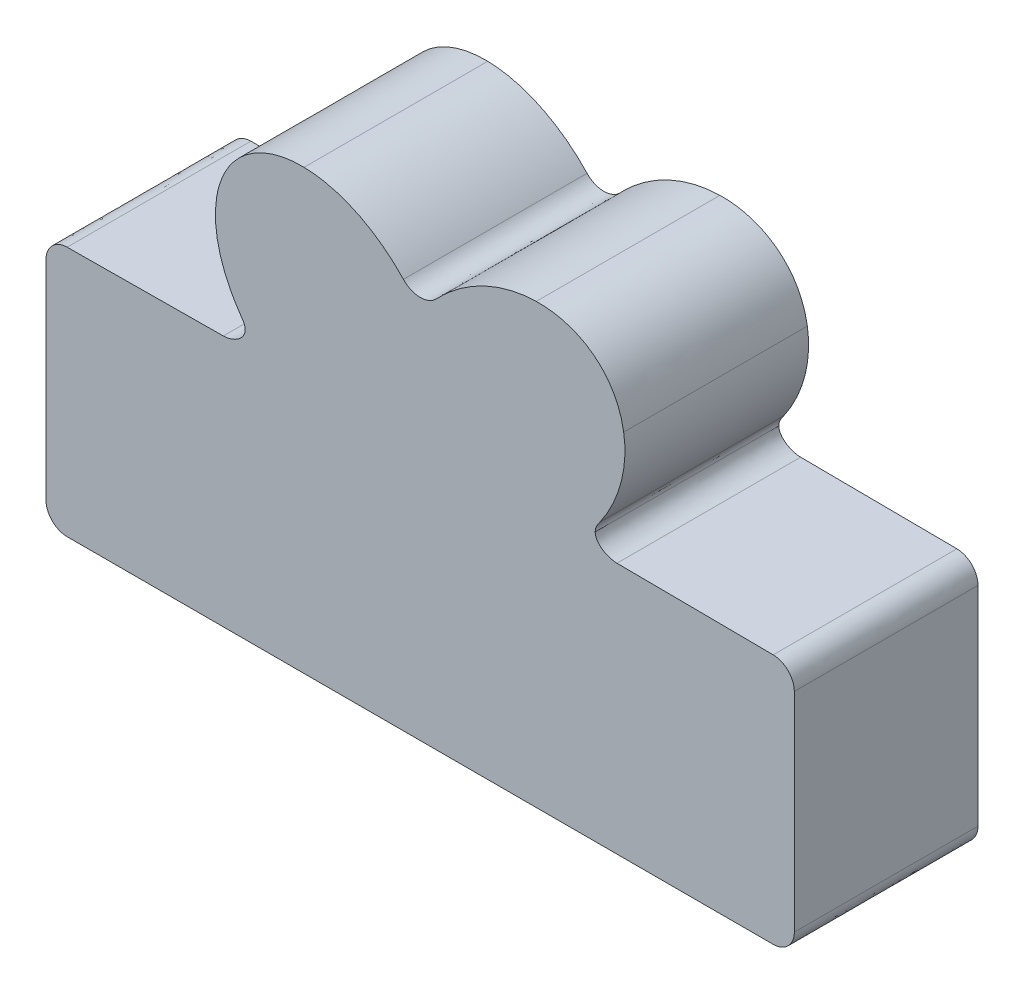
SolidWorks part; units mm, degrees
ref_plane "Front Plane" through (0, 0, 0) normal (0, 0, 1) x (1, 0, 0)
ref_plane "Top Plane" through (0, 0, 0) normal (0, 1, 0) x (1, 0, 0)
ref_plane "Right Plane" through (0, 0, 0) normal (1, 0, 0) x (0, 0, -1)
sketch "Sketch1" plane through (0, 0, 0) normal (0, 0, 1) x (1, 0, 0)
  spline S0 degree 3 poles (569.776, 314.7059) (569.9964, 313.3349) (569.5259, 311.9156) (568.741, 310.7959) knots 0 0 0 0 0.047619 0.047619 0.047619 0.047619
  spline S1 degree 3 poles (568.741, 310.7959) (568.6346, 310.644) (568.5341, 310.519) (568.5351, 310.3218) knots 0.047619 0.047619 0.047619 0.047619 0.095238 0.095238 0.095238 0.095238
  spline S2 degree 3 poles (568.5351, 310.3218) (568.5375, 309.9023) (569.078, 309.6176) (569.4831, 309.6146) knots 0.095238 0.095238 0.095238 0.095238 0.142857 0.142857 0.142857 0.142857
  spline S3 degree 2 poles (569.4831, 309.6146) (569.4831, 309.6146) (576.2875, 309.5617) knots 0.142857 0.142857 0.142857 0.190476 0.190476 0.190476
  spline S4 degree 3 poles (576.2875, 309.5617) (576.7938, 309.5579) (577.2084, 309.1471) (577.2084, 308.6408) knots 0.190476 0.190476 0.190476 0.190476 0.238095 0.238095 0.238095 0.238095
  spline S5 degree 2 poles (577.2084, 308.6408) (577.2084, 308.6408) (577.2084, 299.5617) knots 0.238095 0.238095 0.238095 0.285714 0.285714 0.285714
  spline S6 degree 3 poles (577.2084, 299.5617) (577.2084, 299.0554) (576.794, 298.6397) (576.2875, 298.6408) knots 0.285714 0.285714 0.285714 0.285714 0.333333 0.333333 0.333333 0.333333
  spline S7 degree 2 poles (576.2875, 298.6408) (576.2875, 298.6408) (545.5351, 298.6408) knots 0.333333 0.333333 0.333333 0.380952 0.380952 0.380952
  spline S8 degree 3 poles (545.5351, 298.6408) (545.0286, 298.6397) (544.6142, 299.0554) (544.6142, 299.5617) knots 0.380952 0.380952 0.380952 0.380952 0.428571 0.428571 0.428571 0.428571
  spline S9 degree 2 poles (544.6142, 299.5617) (544.6142, 299.5617) (544.6142, 308.6408) knots 0.428571 0.428571 0.428571 0.47619 0.47619 0.47619
  spline S10 degree 3 poles (544.6142, 308.6408) (544.6142, 309.1471) (545.0288, 309.5579) (545.5351, 309.5617) knots 0.47619 0.47619 0.47619 0.47619 0.52381 0.52381 0.52381 0.52381
  spline S11 degree 2 poles (545.5351, 309.5617) (545.5351, 309.5617) (552.3395, 309.6146) knots 0.52381 0.52381 0.52381 0.571429 0.571429 0.571429
  spline S12 degree 3 poles (552.3395, 309.6146) (552.7446, 309.6176) (553.2851, 309.9023) (553.2875, 310.3218) knots 0.571429 0.571429 0.571429 0.571429 0.619048 0.619048 0.619048 0.619048
  spline S13 degree 3 poles (553.2875, 310.3218) (553.2885, 310.519) (553.188, 310.644) (553.0816, 310.7959) knots 0.619048 0.619048 0.619048 0.619048 0.666667 0.666667 0.666667 0.666667
  spline S14 degree 3 poles (553.0816, 310.7959) (552.2967, 311.9156) (551.8262, 313.3349) (552.0466, 314.7059) knots 0.666667 0.666667 0.666667 0.666667 0.714286 0.714286 0.714286 0.714286
  spline S15 degree 3 poles (552.0466, 314.7059) (552.3552, 316.6254) (553.9301, 317.7737) (555.8547, 317.7338) knots 0.714286 0.714286 0.714286 0.714286 0.761905 0.761905 0.761905 0.761905
  spline S16 degree 3 poles (555.8547, 317.7338) (557.5018, 317.6997) (559.07, 316.8576) (560.182, 315.6731) knots 0.761905 0.761905 0.761905 0.761905 0.809524 0.809524 0.809524 0.809524
  spline S17 degree 3 poles (560.182, 315.6731) (560.5771, 315.2518) (561.2455, 315.2518) (561.6406, 315.6731) knots 0.809524 0.809524 0.809524 0.809524 0.857143 0.857143 0.857143 0.857143
  spline S18 degree 3 poles (561.6406, 315.6731) (562.7526, 316.8576) (564.3208, 317.6997) (565.9679, 317.7338) knots 0.857143 0.857143 0.857143 0.857143 0.904762 0.904762 0.904762 0.904762
  spline S19 degree 3 poles (565.9679, 317.7338) (567.8925, 317.7737) (569.4674, 316.6254) (569.776, 314.7059) knots 0.904762 0.904762 0.904762 0.904762 1 1 1 1
extrude "Boss-Extrude1" add sketch "Sketch1" along normal blind 8
